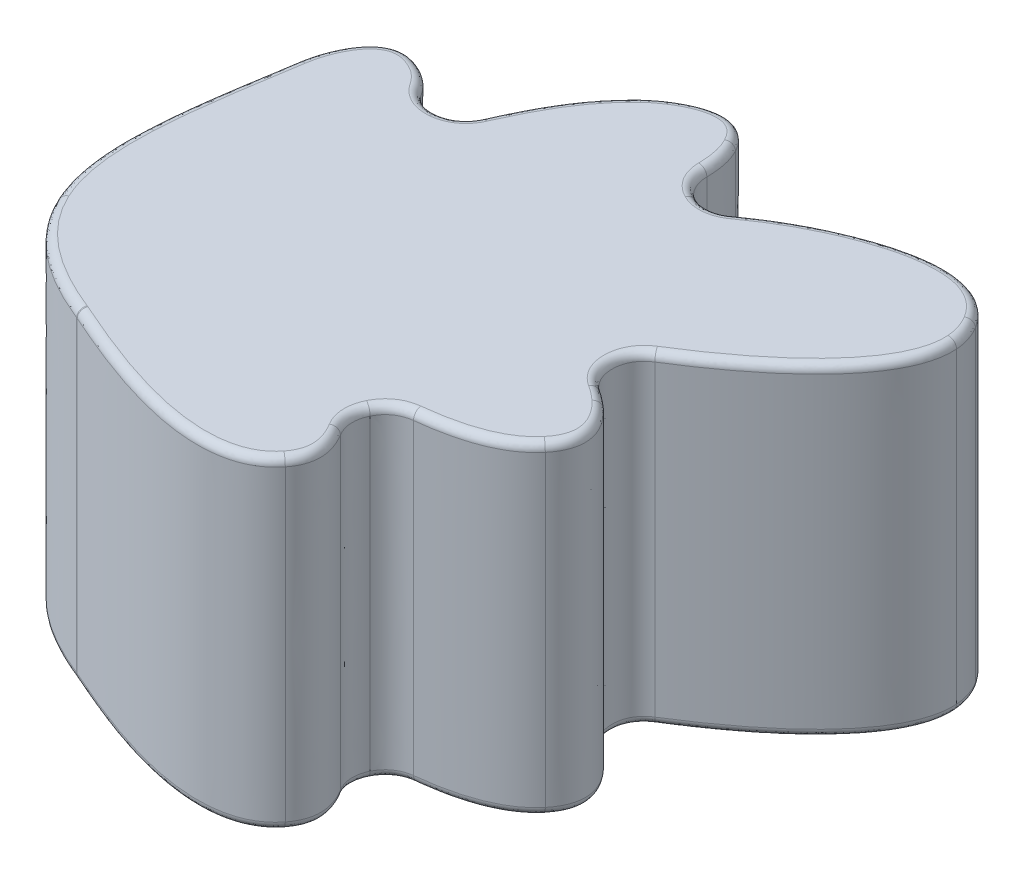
SolidWorks part; units mm, degrees
ref_plane "Front Plane" through (0, 0, 0) normal (0, 0, 1) x (1, 0, 0)
ref_plane "Top Plane" through (0, 0, 0) normal (0, 1, 0) x (1, 0, 0)
ref_plane "Right Plane" through (0, 0, 0) normal (1, 0, 0) x (0, 0, -1)
body saved out of another part "Stock-Wooden Clock Video-1"
fillet "Fillet1" radius 0.5 46 edges
